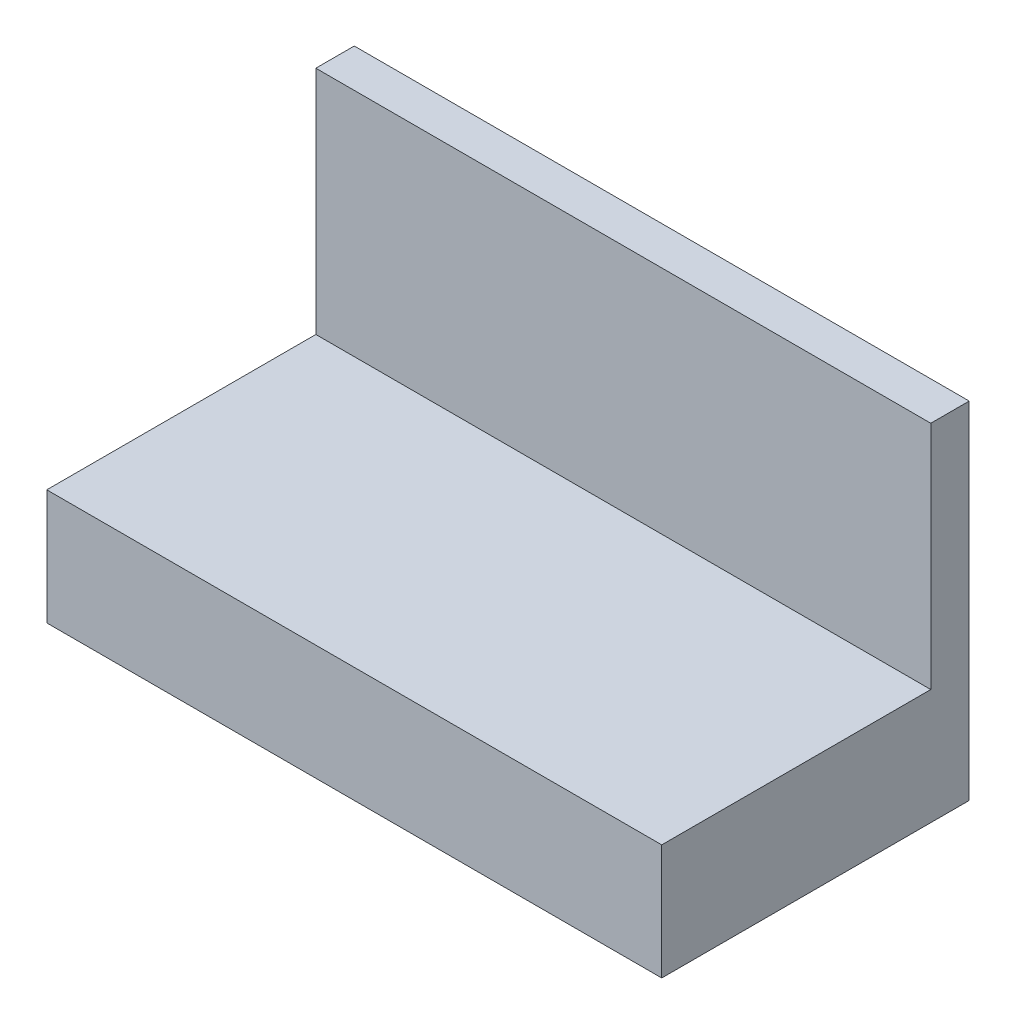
SolidWorks part; units mm, degrees
ref_plane "Face" through (0, 0, 0) normal (0, 0, 1) x (1, 0, 0)
ref_plane "Dessus" through (0, 0, 0) normal (0, 1, 0) x (1, 0, 0)
ref_plane "Droite" through (0, 0, 0) normal (1, 0, 0) x (0, 0, -1)
sketch "Esquisse2" plane through (0, 0, 0) normal (1, 0, 0) x (0, 0, -1)
  line L0 (0, 0) -> (0, 3)
  line L1 (7, 3) -> (7, 9)
  line L2 (7, 9) -> (8, 9)
  line L3 (1, 3) -> (7, 3)
  line L4 (8, 2.4448) -> (8, 0)
  line L5 (8, 0) -> (0, 0)
  line L6 (1, 3) -> (0, 3)
  line L7 (8, 9) -> (8, 2.4448)
  dimension "D1" = 6
  dimension "D2" = 3
  dimension "D3" = 1
  dimension "D4" = 8
extrude "Extrusion1" add sketch "Esquisse2" against normal blind 16
sketch "Esquisse3" plane through (0, 0, 0) normal (0, -1, 0) x (1, 0, 0)
  line L0 (0, 0) -> (0, -8) construction
  line L1 (-1, -1) -> (-15, -1)
  line L2 (-1, -1) -> (-1, -7)
  line L3 (-1, -7) -> (-15, -7)
  line L4 (-15, -1) -> (-15, -7)
  line L5 (-16, 0) -> (-16, -8) construction
  line L6 (-16, -8) -> (0, -8) construction
  line L7 (-16, 0) -> (0, 0) construction
  dimension "D1" = 1
  dimension "D2" = 1
  dimension "D3" = 1
  dimension "D4" = 1
extrude "Enlèv. mat.-Extru.1" cut sketch "Esquisse3" against normal blind 2
sketch "Esquisse4" plane through (0, 2, 0) normal (0, -1, 0) x (1, 0, 0)
  line L0 (-16, 0) -> (0, 0) construction
  line L1 (-16, 0) -> (-16, -8) construction
  circle A0 centre (-8, -4) radius 1.5
  circle A1 centre (-8, -4) radius 1
  dimension "D1" = 2
  dimension "D2" = 3
  dimension "D3" = 4
  dimension "D4" = 8
extrude "Extrusion2" add sketch "Esquisse4" along normal blind 2
